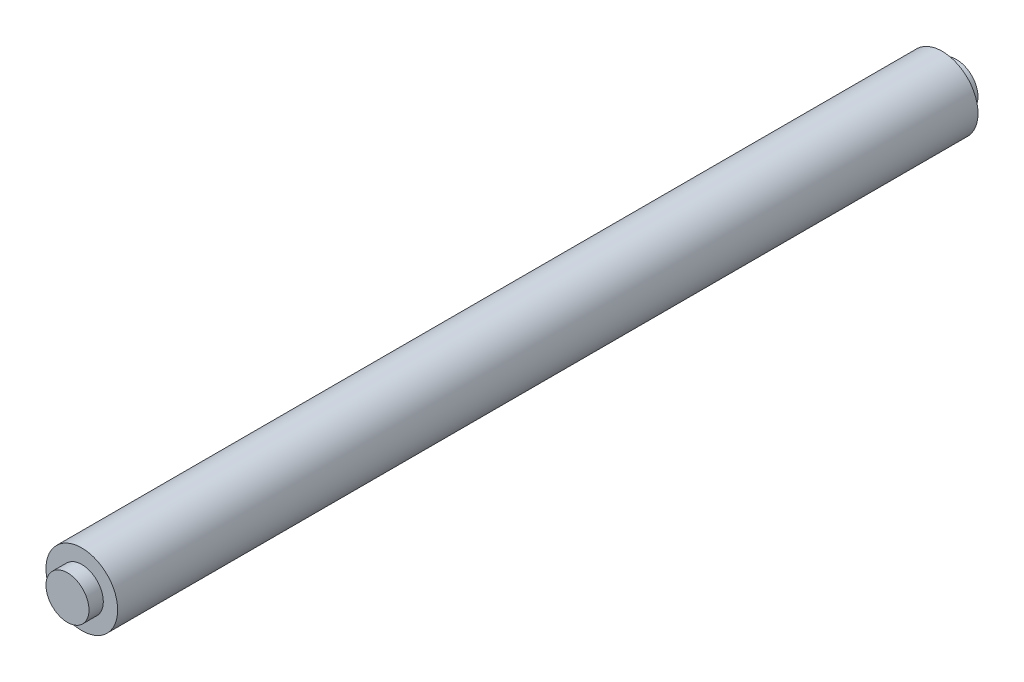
SolidWorks part; units mm, degrees
ref_plane "Alzado" through (0, 0, 0) normal (0, 0, 1) x (1, 0, 0)
ref_plane "Planta" through (0, 0, 0) normal (0, 1, 0) x (1, 0, 0)
ref_plane "Vista lateral" through (0, 0, 0) normal (1, 0, 0) x (0, 0, -1)
sketch "Croquis1" plane through (0, 0, 0) normal (0, 0, 1) x (1, 0, 0)
  circle A0 centre (0, 0) radius 25
  dimension "D1" = 50
extrude "Saliente-Extruir1" add sketch "Croquis1" along normal blind 600
sketch "Croquis2" plane through (0, 0, 600) normal (0, 0, 1) x (1, 0, 0)
  circle A0 centre (0, 0) radius 15
  dimension "D1" = 30
extrude "Saliente-Extruir2" add sketch "Croquis2" along normal blind 10
sketch "Croquis3" plane through (0, 0, 0) normal (0, 0, -1) x (-1, 0, 0)
  circle A0 centre (0, 0) radius 15
  dimension "D1" = 30
extrude "Saliente-Extruir3" add sketch "Croquis3" along normal blind 10
